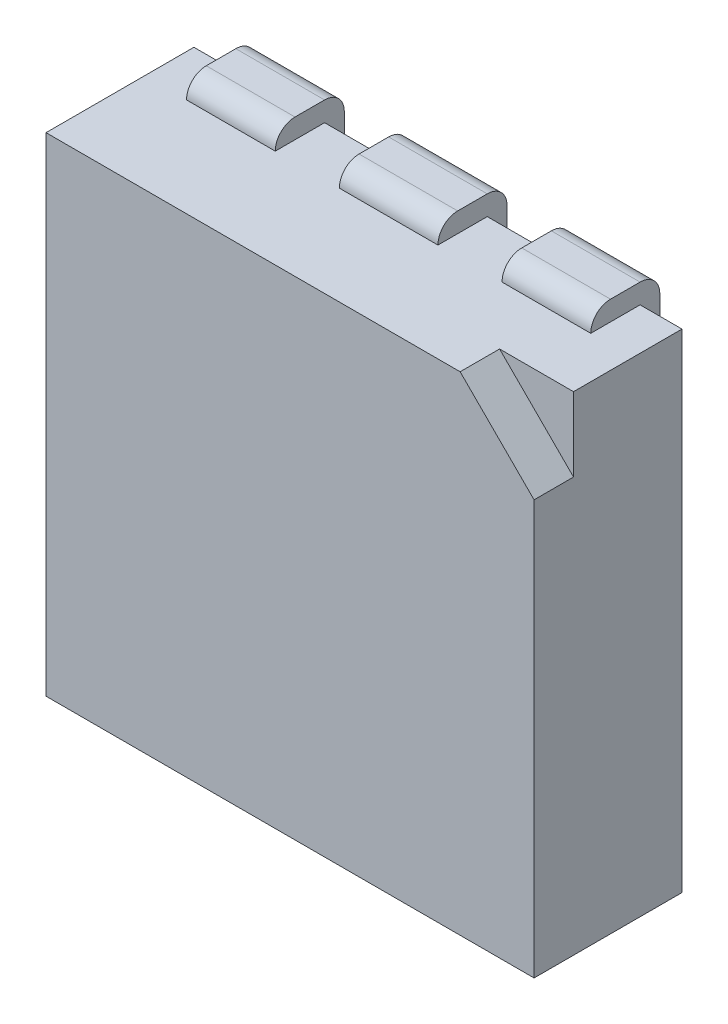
SolidWorks part; units mm, degrees
ref_plane "Front Plane" through (0, 0, 0) normal (0, 0, 1) x (1, 0, 0)
ref_plane "Top Plane" through (0, 0, 0) normal (0, 1, 0) x (1, 0, 0)
ref_plane "Right Plane" through (0, 0, 0) normal (1, 0, 0) x (0, 0, -1)
imported_body "Imported1"
sketch "Sketch1" plane through (0.5, 0, 0) normal (-1, 0, 0) x (0, 0, 1)
  line L4 (-0.2, 2.475) -> (-0.2, 1.625)
  line L5 (0, 1.425) -> (0, 2.475)
  line L6 (0, 2.475) -> (0.5, 2.475)
  line L7 (0.3, 2.675) -> (0, 2.675)
  line L8 (-0.2, 2.475) -> (-0.2, 1.625)
  line L10 (0.15, 2.475) -> (0.5, 2.475)
  line L11 (0.3, 2.675) -> (0, 2.675)
  line L12 (0, 2.475) -> (0, 1.425)
  line L13 (0, 1.425) -> (0.15, 1.425)
  line L14 (0.15, 1.425) -> (0.15, 2.475)
  line L15 (0.15, 2.475) -> (0, 2.475)
  line L17 (0, 1.425) -> (0.15, 1.425)
  line L18 (0.15, 1.425) -> (0.15, 2.475)
  arc A3 (-0.2, 1.625) -> (0, 1.425) centre (0, 1.625) ccw
  arc A4 (0.5, 2.475) -> (0.3, 2.675) centre (0.3, 2.475) ccw
  arc A5 (0, 2.675) -> (-0.2, 2.475) centre (0, 2.475) ccw
  arc A6 (-0.2, 1.625) -> (0, 1.425) centre (0, 1.625) ccw
  arc A7 (0.5, 2.475) -> (0.3, 2.675) centre (0.3, 2.475) ccw
  arc A8 (0, 2.675) -> (-0.2, 2.475) centre (0, 2.475) ccw
  dimension "D1" = 0
  dimension "D2" = 0
extrude "Boss-Extrude1" add sketch "Sketch1" along normal blind 1
mirror "Mirror1" about plane through (0, 0, 0) normal (0, 1, 0) of "Boss-Extrude1"
sketch "Sketch2" plane through (0, 0, 1.5) normal (0, 0, 1) x (1, 0, 0)
  line L5 (2.475, 1.725) -> (1.725, 2.475)
  line L6 (1.725, 2.475) -> (-2.475, 2.475)
  line L7 (-2.475, 2.475) -> (-2.475, -2.475)
  line L8 (-2.475, -2.475) -> (2.475, -2.475)
  line L9 (2.475, -2.475) -> (2.475, 1.725)
  line L10 (2.475, 1.725) -> (1.725, 2.475)
  line L11 (1.725, 2.475) -> (-2.475, 2.475)
  line L12 (-2.475, 2.475) -> (-2.475, -2.475)
  line L13 (-2.475, -2.475) -> (2.475, -2.475)
  line L14 (2.475, -2.475) -> (2.475, 1.725)
  dimension "D1" = 0
extrude "Boss-Extrude2" add sketch "Sketch2" against normal blind 1
